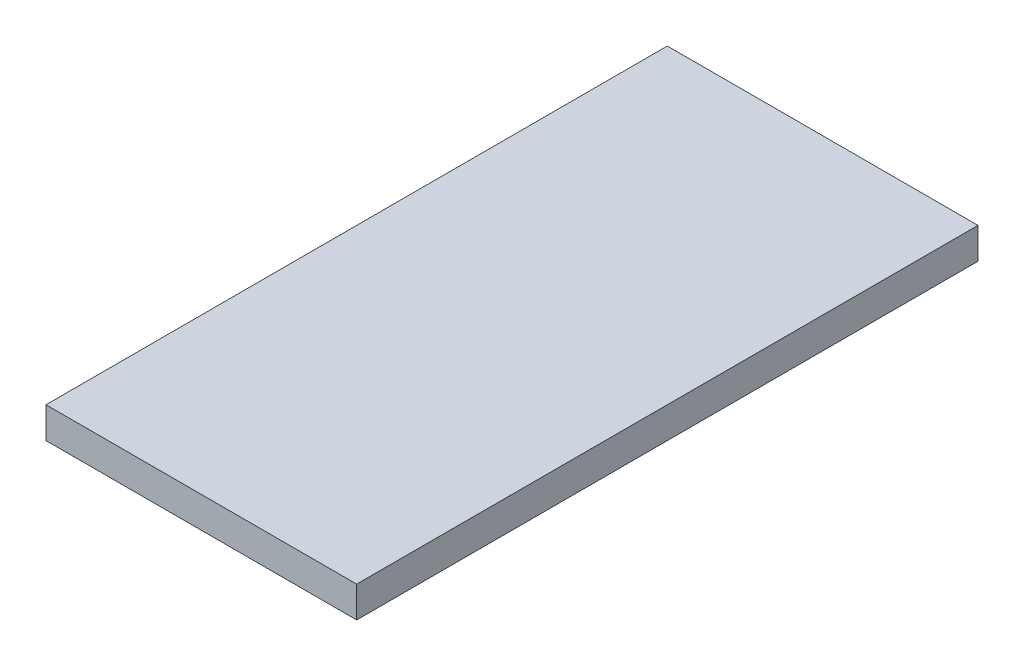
SolidWorks part; units mm, degrees
ref_plane "Plane1" through (0, 0, 0) normal (0, 0, 1) x (1, 0, 0)
ref_plane "Plane2" through (0, 0, 0) normal (0, 1, 0) x (1, 0, 0)
ref_plane "Plane3" through (0, 0, 0) normal (1, 0, 0) x (0, 0, -1)
sketch "Sketch1" plane through (0, 0, 0) normal (0, 0, 1) x (1, 0, 0)
  line L0 (0, -5) -> (0, 5) construction
  line L1 (-50, 5) -> (50, 5)
  line L2 (-50, 5) -> (-50, -5)
  line L3 (-50, -5) -> (50, -5)
  line L4 (50, 5) -> (50, -5)
  dimension "b" = 100
  dimension "h" = 10
extrude "Extrude1" add sketch "Sketch1" along normal mid plane 200
